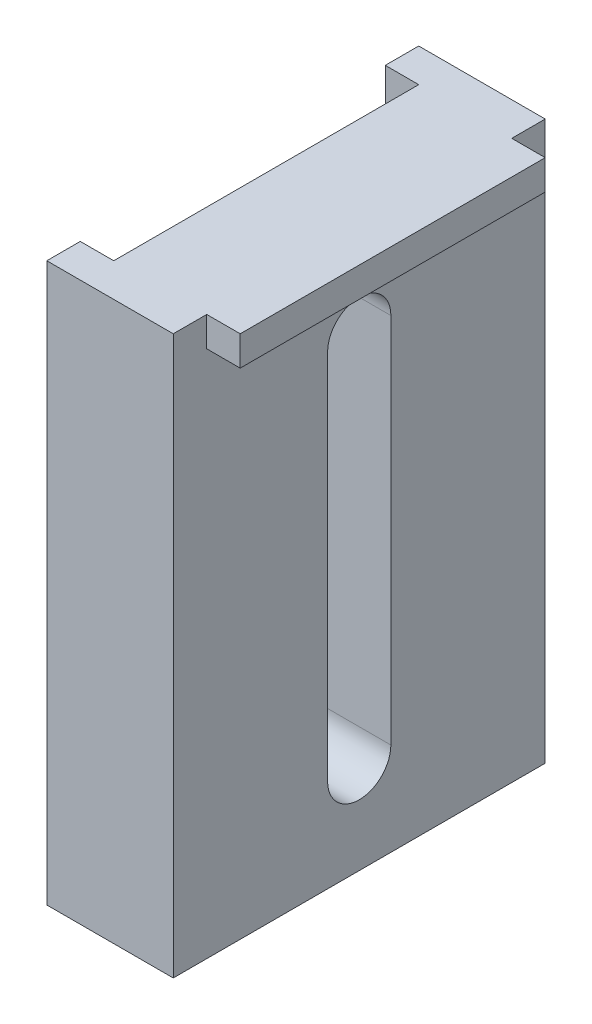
SolidWorks part; units mm, degrees
ref_plane "Plan de face" through (0, 0, 0) normal (0, 0, 1) x (1, 0, 0)
ref_plane "Plan de dessus" through (0, 0, 0) normal (0, 1, 0) x (1, 0, 0)
ref_plane "Plan de droite" through (0, 0, 0) normal (1, 0, 0) x (0, 0, -1)
sketch "Esquisse1" plane through (0, 0, 0) normal (0, 0, 1) x (1, 0, 0)
  line L0 (0, 0) -> (0, 71)
  line L1 (0, 71) -> (4.5, 71)
  line L2 (4.5, 71) -> (4.5, 75)
  line L3 (4.5, 75) -> (-17, 75)
  line L4 (-17, 75) -> (-17, 0)
  line L5 (-17, 0) -> (0, 0)
  dimension "D1" = 17
  dimension "D2" = 75
  dimension "D3" = 4.5
  dimension "D4" = 4
extrude "Extrusion1" add sketch "Esquisse1" along normal mid plane 50
sketch "Esquisse2" plane through (-17, 0, 0) normal (-1, 0, 0) x (0, 0, 1)
  line L0 (25, 0) -> (-25, 0) construction
  line L1 (-20.5, 0) -> (20.5, 0)
  line L2 (-20.5, 0) -> (-20.5, 71)
  line L3 (-20.5, 71) -> (20.5, 71)
  line L4 (20.5, 0) -> (20.5, 71)
  line L5 (25, 71) -> (-25, 71) construction
  line L6 (-25, 75) -> (-25, 0) construction
  dimension "D1" = 41
  dimension "D2" = 4.5
extrude "Enlèv. mat.-Extru.1" cut sketch "Esquisse2" against normal blind 2
sketch "Esquisse3" plane through (-17, 0, 0) normal (-1, 0, 0) x (0, 0, 1)
  line L0 (20.5, 0) -> (20.5, 71) construction
  line L2 (-20.5, 71) -> (20.5, 71)
  line L3 (-20.5, 71) -> (-20.5, 75)
  line L4 (-20.5, 75) -> (20.5, 75)
  line L5 (20.5, 71) -> (20.5, 75)
  line L6 (-20.5, 71) -> (-20.5, 0) construction
  line L7 (25, 75) -> (-25, 75) construction
  line L8 (20.5, 71) -> (-20.5, 71) construction
extrude "Enlèv. mat.-Extru.2" cut sketch "Esquisse3" against normal blind 4.5
sketch "Sketch2" plane through (-15, -52.8003, -97.8484) normal (-1, 0, 0) x (0, 0, 1)
  line L0 (93.5984, 115.3003) -> (93.5984, 65.3003)
  line L1 (102.0984, 115.3003) -> (102.0984, 65.3003)
  line L2 (97.8484, 65.3003) -> (97.8484, 115.3003) construction
  line L3 (93.5984, 90.3003) -> (102.0984, 90.3003) construction
  line L4 (72.8484, 127.8003) -> (72.8484, 52.8003) construction
  line L5 (77.3484, 52.8003) -> (118.3484, 52.8003) construction
  arc A0 (102.0984, 115.3003) -> (93.5984, 115.3003) centre (97.8484, 115.3003) ccw
  arc A1 (93.5984, 65.3003) -> (102.0984, 65.3003) centre (97.8484, 65.3003) ccw
  dimension "D1" = 50
  dimension "D2" = 12.5
  dimension "D3" = 25
  dimension "D4" = 8.5
extrude "lumiere1" cut sketch "Sketch2" against normal up to next
ref_plane "Plan1" through (0, 0, 0) normal (0, 0, 1) x (1, 0, 0)
sketch "Esquisse4" plane through (0, 71, 0) normal (0, -1, 0) x (1, 0, 0)
  line L1 (-15, 20.5) -> (-17, 20.5) construction
  line L2 (0, -25) -> (4.5, -25)
  line L3 (0, -25) -> (0, -20.5)
  line L4 (0, -20.5) -> (4.5, -20.5)
  line L8 (4.5, -25) -> (4.5, -20.5)
  line L9 (0, 25) -> (4.5, 25)
  line L10 (0, 25) -> (0, 20.5)
  line L11 (0, 20.5) -> (4.5, 20.5)
  line L12 (4.5, 25) -> (4.5, 20.5)
  line L13 (-15, -20.5) -> (-17, -20.5) construction
  line L14 (4.5, 25) -> (4.5, -25) construction
extrude "Enlèv. mat.-Extru.4" cut sketch "Esquisse4" against normal through all
